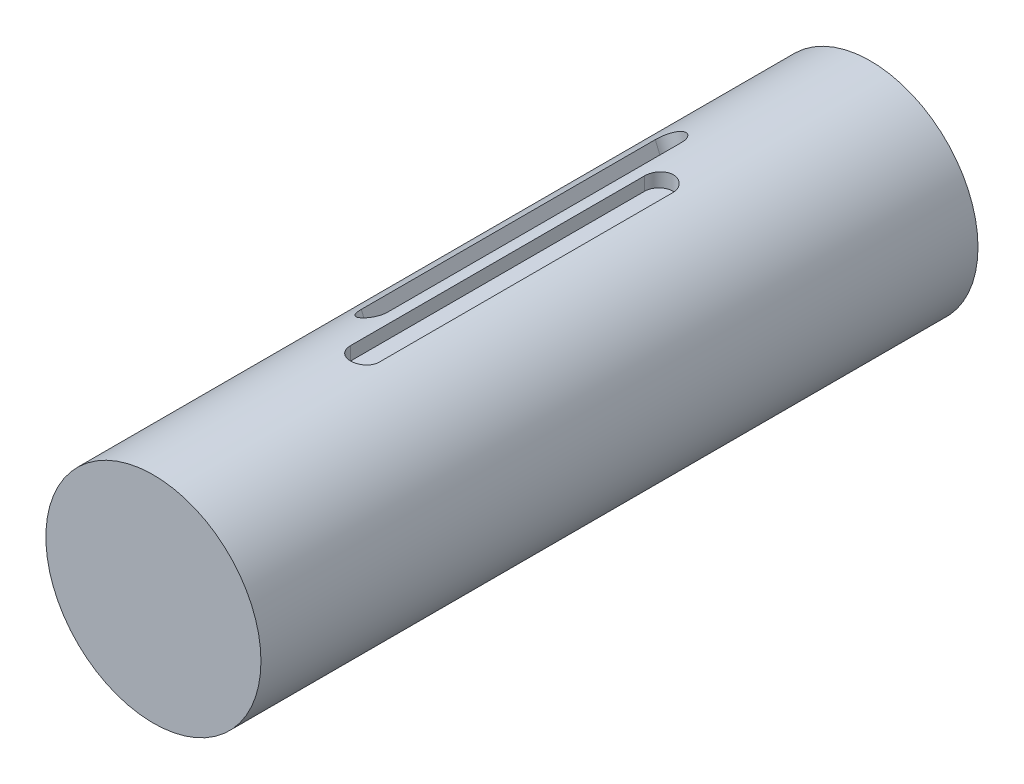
SolidWorks part; units mm, degrees
ref_plane "Ebene vorne" through (0, 0, 0) normal (0, 0, 1) x (1, 0, 0)
ref_plane "Ebene oben" through (0, 0, 0) normal (0, 1, 0) x (1, 0, 0)
ref_plane "Ebene rechts" through (0, 0, 0) normal (1, 0, 0) x (0, 0, -1)
sketch "Skizze1" plane through (0, 0, 0) normal (0, 0, 1) x (1, 0, 0)
  line L0 (0, 15) -> (0, 0) construction
  line L1 (0, 0) -> (15, 0) construction
  circle A0 centre (0, 0) radius 15
  circle A1 centre (0, 0) radius 13 construction
  point P6 (0, 13)
  dimension "D1" = 30
  dimension "D2" = 2
extrude "Linear austragen1" add sketch "Skizze1" against normal mid plane 100
other "Formnest1"
other "STEMPEL 1<1>@ZLOZENIE1"
other "STEMPEL 1<4>@ZLOZENIE1"
equation "\"LÄNGE\"=0"
equation "\"BREITE\"=0"
equation "\"HÖHE\"=0"
equation "\"DURCHMESSER\"=0"
equation "\"Stückzahl\"= 1"
